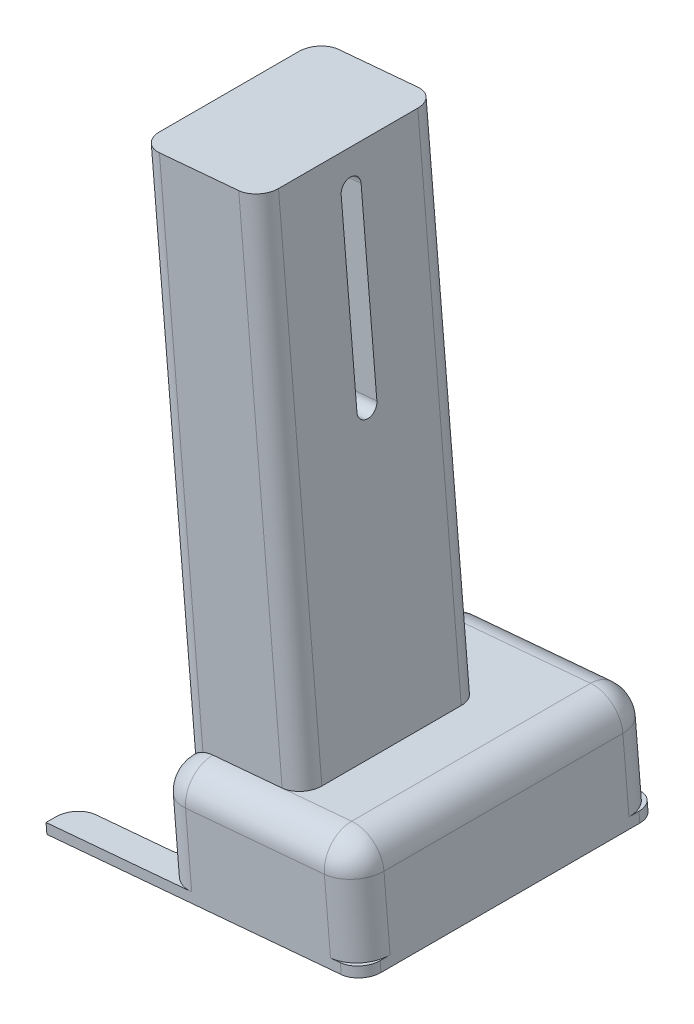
SolidWorks part; units mm, degrees
ref_plane "Plan de face" through (0, 0, 0) normal (0, 0, 1) x (1, 0, 0)
ref_plane "Plan de dessus" through (0, 0, 0) normal (0, 1, 0) x (1, 0, 0)
ref_plane "Plan de droite" through (0, 0, 0) normal (1, 0, 0) x (0, 0, -1)
mirrored part "jambe-droite_Rendre symétrique"
other "<jambe-droite>-<Enlèv. mat.-Extru.1>"
